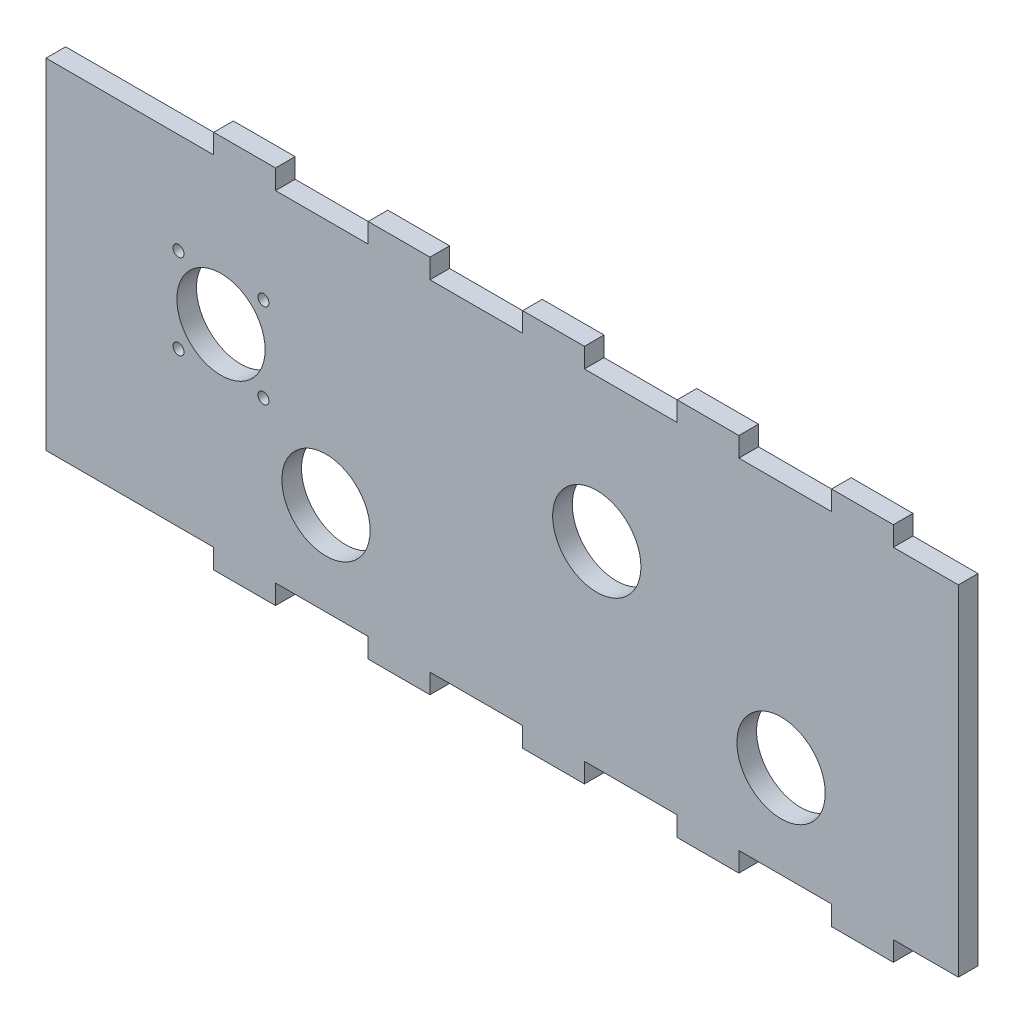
SolidWorks part; units mm, degrees
ref_plane "Front Plane" through (0, 0, 0) normal (0, 0, 1) x (1, 0, 0)
ref_plane "Top Plane" through (0, 0, 0) normal (0, 1, 0) x (1, 0, 0)
ref_plane "Right Plane" through (0, 0, 0) normal (1, 0, 0) x (0, 0, -1)
sketch "Sketch1" plane through (0, 0, 0) normal (0, 0, 1) x (1, 0, 0)
  line L0 (178.3064, 63.6704) -> (178.3064, 30) construction
  line L1 (0, 0) -> (295.36, 0) construction
  line L5 (90.64, 30) -> (237.96, 30) construction
  line L6 (178.3064, 63.6704) -> (178.3064, 30) construction
  line L7 (164.3, 30) -> (164.3, 0) construction
  line L8 (0, 0) -> (54.3, 0)
  line L9 (54.3, 0) -> (54.3, -6.35)
  line L10 (42.8976, 77.4192) -> (70.3951, 49.9216) construction
  line L11 (42.8976, 49.9216) -> (70.3951, 77.4192) construction
  line L12 (54.3, -6.35) -> (74.3, -6.35)
  line L13 (74.3, -6.35) -> (74.3, 0)
  line L18 (295.36, 0) -> (295.36, 110)
  line L19 (295.36, 110) -> (0, 110) construction
  line L20 (0, 110) -> (0, 0)
  line L21 (74.3, 0) -> (104.3, 0)
  line L22 (104.3, 0) -> (104.3, -6.35)
  line L23 (104.3, -6.35) -> (124.3, -6.35)
  line L24 (124.3, -6.35) -> (124.3, 0)
  line L25 (124.3, 0) -> (154.3, 0)
  line L26 (154.3, 0) -> (154.3, -6.35)
  line L27 (154.3, -6.35) -> (174.3, -6.35)
  line L28 (174.3, -6.35) -> (174.3, 0)
  line L29 (174.3, 0) -> (204.3, 0)
  line L30 (204.3, 0) -> (204.3, -6.35)
  line L31 (204.3, -6.35) -> (224.3, -6.35)
  line L32 (224.3, -6.35) -> (224.3, 0)
  line L33 (224.3, 0) -> (254.3, 0)
  line L34 (254.3, 0) -> (254.3, -6.35)
  line L35 (254.3, -6.35) -> (274.3, -6.35)
  line L36 (274.3, -6.35) -> (274.3, 0)
  line L37 (274.3, 0) -> (295.36, 0)
  line L38 (0, 55) -> (295.36, 55) construction
  line L39 (274.3, 110) -> (295.36, 110)
  line L40 (274.3, 116.35) -> (274.3, 110)
  line L41 (254.3, 116.35) -> (274.3, 116.35)
  line L42 (254.3, 110) -> (254.3, 116.35)
  line L43 (224.3, 110) -> (254.3, 110)
  line L44 (224.3, 116.35) -> (224.3, 110)
  line L45 (204.3, 116.35) -> (224.3, 116.35)
  line L46 (204.3, 110) -> (204.3, 116.35)
  line L47 (174.3, 110) -> (204.3, 110)
  line L48 (174.3, 116.35) -> (174.3, 110)
  line L49 (154.3, 116.35) -> (174.3, 116.35)
  line L50 (154.3, 110) -> (154.3, 116.35)
  line L51 (124.3, 110) -> (154.3, 110)
  line L52 (124.3, 116.35) -> (124.3, 110)
  line L53 (104.3, 116.35) -> (124.3, 116.35)
  line L54 (104.3, 110) -> (104.3, 116.35)
  line L55 (74.3, 110) -> (104.3, 110)
  line L56 (74.3, 116.35) -> (74.3, 110)
  line L57 (54.3, 116.35) -> (74.3, 116.35)
  line L58 (54.3, 110) -> (54.3, 116.35)
  line L59 (0, 110) -> (54.3, 110)
  circle A0 centre (90.64, 30) radius 14.2875
  circle A1 centre (237.96, 30) radius 14.2875
  circle A2 centre (178.3064, 63.6704) radius 14.2875
  circle A3 centre (56.6464, 63.6704) radius 14.2875
  circle A4 centre (56.6464, 63.6704) radius 19.4437 construction
  circle A5 centre (42.8976, 77.4192) radius 1.778
  circle A6 centre (42.8976, 49.9216) radius 1.778
  circle A7 centre (70.3951, 77.4192) radius 1.778
  circle A8 centre (70.3951, 49.9216) radius 1.778
  circle A9 centre (56.6464, 63.6704) radius 30.48 construction
  point P2 (164.3, -6.35)
  dimension "D2" = 28.575
  dimension "D3" = 147.32
  dimension "D4" = 121.66
  dimension "D9" = 38.8874
  dimension "D10" = 3.556
  dimension "D13" = 60.96
  dimension "D5" = 30
  dimension "D6" = 68.5
  dimension "D7" = 93.91
  dimension "D8" = 20
  dimension "D11" = 30
  dimension "D12" = 6.35
  dimension "D14" = 54.3
  dimension "D15" = 21.06
  dimension "D16" = 110
  dimension "D17" = 295.36
  dimension "D18" = 122.7
extrude "Boss-Extrude1" add sketch "Sketch1" along normal blind 6.35
